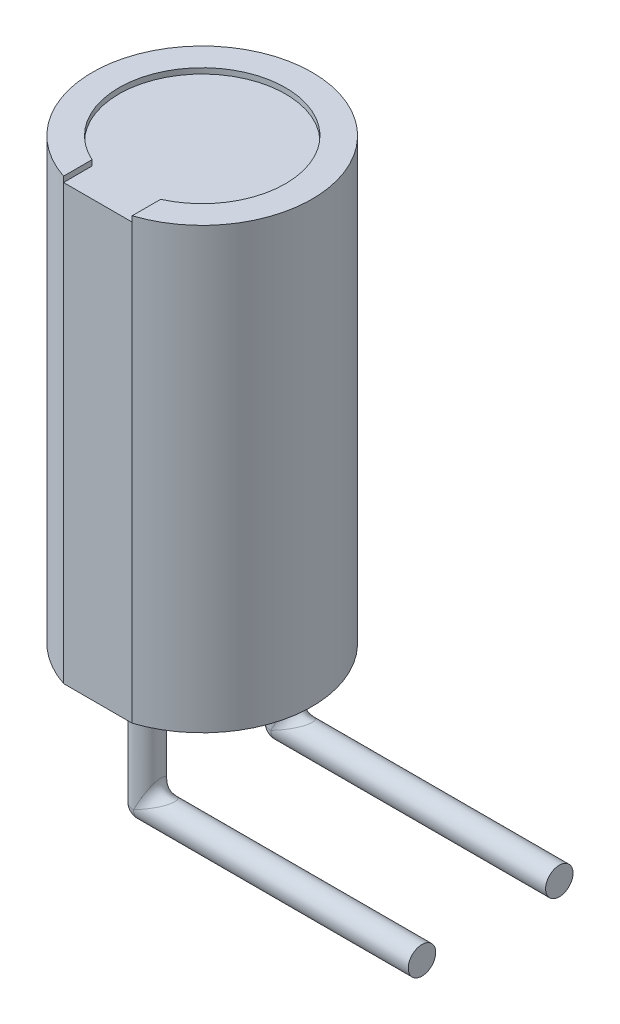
SolidWorks part; units mm, degrees
ref_plane "Plan de face" through (0, 0, 0) normal (0, 0, 1) x (1, 0, 0)
ref_plane "Plan de dessus" through (0, 0, 0) normal (0, 1, 0) x (1, 0, 0)
ref_plane "Plan de droite" through (0, 0, 0) normal (1, 0, 0) x (0, 0, -1)
sketch "Esquisse1" plane through (0, 0, 0) normal (0, 1, 0) x (1, 0, 0)
  circle A0 centre (0, 0) radius 2
  dimension "D1" = 4
extrude "Extrusion1" add sketch "Esquisse1" along normal blind 8
ref_plane "Plan1" through (0, 0, 2) normal (0, 0, 1) x (1, 0, 0)
sketch "Esquisse2" plane through (0, 0, 2) normal (0, 0, 1) x (1, 0, 0)
  line L0 (-2, 0) -> (2, 0) construction
  line L1 (-1, 0) -> (1, 0)
  line L2 (-1, 0) -> (-1, 8)
  line L3 (-1, 8) -> (1, 8)
  line L4 (1, 0) -> (1, 8)
  line L5 (2, 8) -> (-2, 8) construction
  dimension "D1" = 2
extrude "Enlèv. mat.-Extru.1" cut sketch "Esquisse2" against normal blind 0.1
sketch "Esquisse3" plane through (0, 0, 0) normal (0, -1, 0) x (1, 0, 0)
  circle A0 centre (0, 1) radius 0.25
  circle A1 centre (0, -1.5) radius 0.25
  dimension "D3" = 0.5
  dimension "D1" = 2.5
  dimension "D2" = 1
sketch "Esquisse4" plane through (0, 8, 0) normal (0, 1, 0) x (-1, 0, 0)
  line L0 (-0.6245, 1.3814) -> (-0.6245, 1.9)
  line L1 (0.6245, 1.3814) -> (0.6245, 1.9)
  line L2 (0.6245, 1.9) -> (-0.6245, 1.9)
  arc A0 (-0.6245, 1.3814) -> (0.6245, 1.3814) centre (0, 0) ccw
extrude "Enlèv. mat.-Extru.2" cut sketch "Esquisse4" against normal blind 0.1
ref_plane "Plan2" through (0, 0, 1) normal (0, 0, 1) x (1, 0, 0)
sketch "Esquisse5" plane through (0, 0, 1) normal (0, 0, 1) x (1, 0, 0)
  line L0 (0, 0) -> (0, -2)
  line L1 (0, -2) -> (5, -2)
  dimension "D1" = 2
  dimension "D2" = 5
sweep "Balayage1" add profiles "Esquisse3" path "Esquisse5"
fillet "Congé1" radius 0.25 2 edges at (0.25, -1.75, 1) (0.25, -1.75, -1.5)
